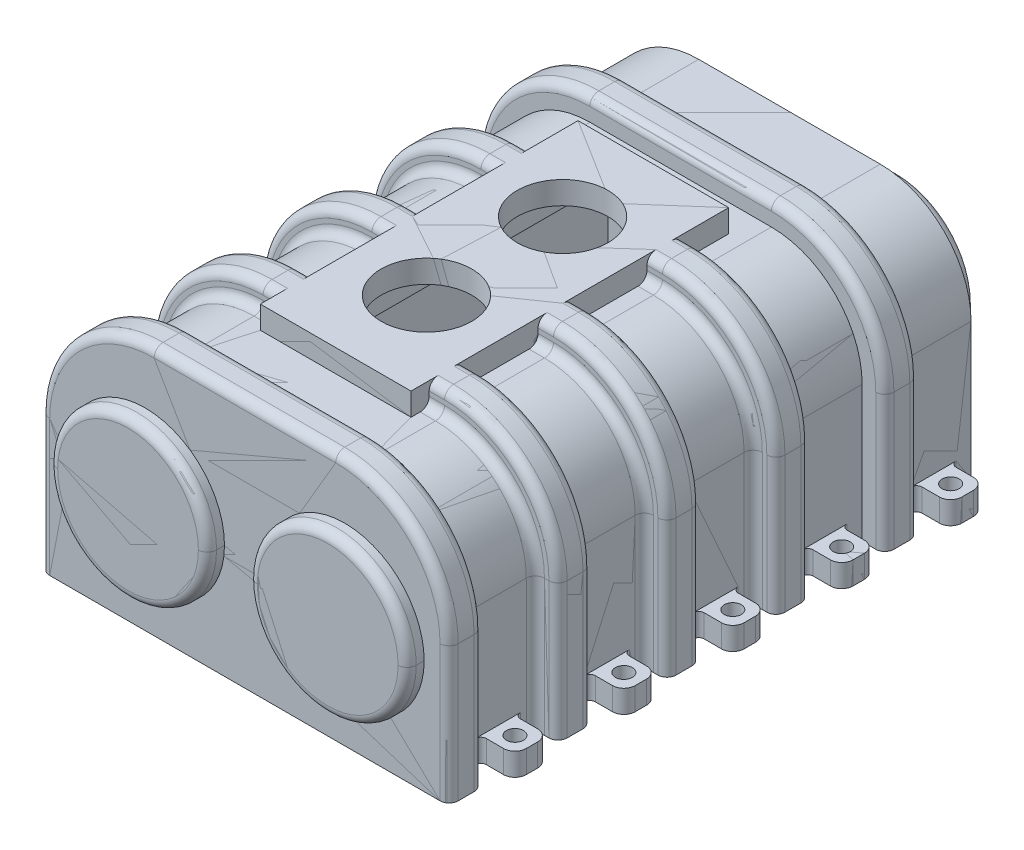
SolidWorks part; units mm, degrees
ref_plane "Front Plane" through (0, 0, 0) normal (0, 0, 1) x (1, 0, 0)
ref_plane "Top Plane" through (0, 0, 0) normal (0, 1, 0) x (1, 0, 0)
ref_plane "Right Plane" through (0, 0, 0) normal (1, 0, 0) x (0, 0, -1)
imported_body "Imported1"
other "Parting Line1"
